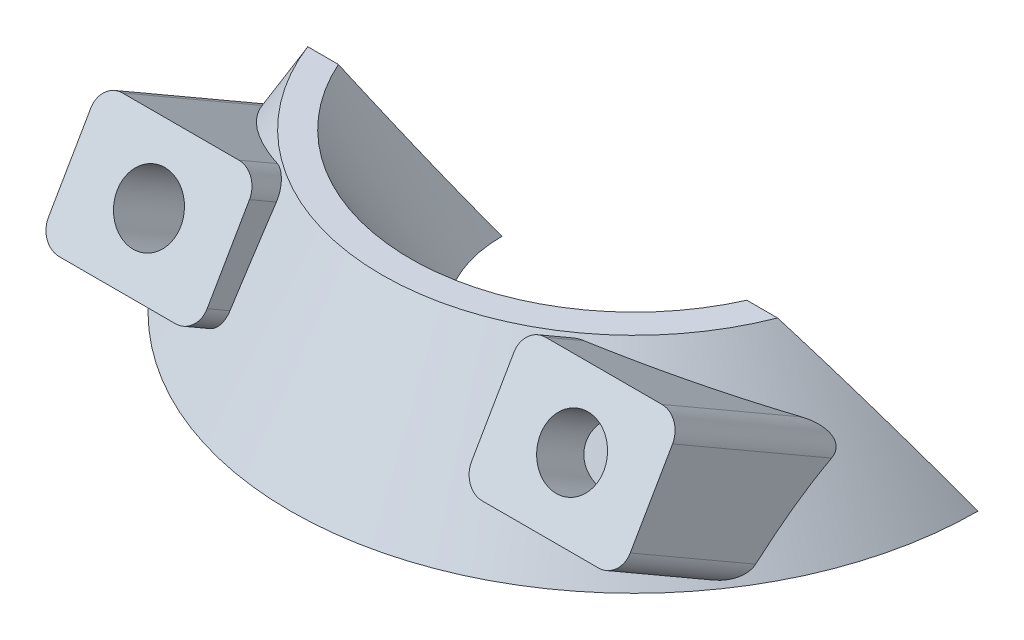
SolidWorks part; units mm, degrees
ref_plane "Front Plane" through (0, 0, 0) normal (0, 0, 1) x (1, 0, 0)
ref_plane "Top Plane" through (0, 0, 0) normal (0, 1, 0) x (1, 0, 0)
ref_plane "Right Plane" through (0, 0, 0) normal (1, 0, 0) x (0, 0, -1)
sketch "Sketch1" plane through (0, 0, 0) normal (0, 1, 0) x (1, 0, 0)
  line L0 (12.5, 0) -> (32.5, 0)
  line L1 (-12.5, 0) -> (-32.5, 0)
  arc A0 (20.5, 0) -> (-20.5, 0) centre (0, 0) cw construction
  arc A1 (12.5, 0) -> (-12.5, 0) centre (0, 0) cw
  arc A2 (32.5, 0) -> (-32.5, 0) centre (0, 0) cw
  dimension "D3" = 25
  dimension "D1" = 8
  dimension "D2" = 12
extrude "Extrude1" add sketch "Sketch1" along normal blind 15 draft 30
ref_plane "Plane1" through (0, 7.5, 28.1699) normal (0, 0.5, 0.866) x (1, 0, 0)
sketch "Sketch2" plane through (0, 7.5, 28.1699) normal (0, 0.5, 0.866) x (1, 0, 0)
  line L1 (14.5, -1.4103) -> (25.5, -1.4103)
  line L2 (12.5, 0.5897) -> (12.5, 8.5897)
  line L3 (14.5, 10.5897) -> (25.5, 10.5897)
  line L4 (27.5, 0.5897) -> (27.5, 8.5897)
  line L6 (14.5, 8.5897) -> (25.5, 0.5897) construction
  line L8 (0, -12.9904) -> (0, 27.3234) construction
  line L10 (-12.5, 0.5897) -> (-12.5, 8.5897)
  line L11 (-14.5, -1.4103) -> (-25.5, -1.4103)
  line L12 (-27.5, 0.5897) -> (-27.5, 8.5897)
  line L13 (-14.5, 10.5897) -> (-25.5, 10.5897)
  arc A0 (12.5, 8.5897) -> (14.5, 10.5897) centre (14.5, 8.5897) cw
  arc A1 (25.5, -1.4103) -> (27.5, 0.5897) centre (25.5, 0.5897) ccw
  arc A2 (14.5, -1.4103) -> (12.5, 0.5897) centre (14.5, 0.5897) cw
  arc A3 (25.5, 10.5897) -> (27.5, 8.5897) centre (25.5, 8.5897) cw
  circle A4 centre (20, 4.5897) radius 3
  circle A5 centre (-20, 4.5897) radius 3
  arc A6 (-12.5, 8.5897) -> (-14.5, 10.5897) centre (-14.5, 8.5897) ccw
  arc A7 (-14.5, -1.4103) -> (-12.5, 0.5897) centre (-14.5, 0.5897) ccw
  arc A8 (-25.5, -1.4103) -> (-27.5, 0.5897) centre (-25.5, 0.5897) cw
  arc A9 (-25.5, 10.5897) -> (-27.5, 8.5897) centre (-25.5, 8.5897) ccw
  point P12 (27.5, -1.4103)
  point P15 (12.5, -1.4103)
  point P18 (27.5, 10.5897)
  dimension "D2" = 15
  dimension "D3" = 12
  dimension "D4" = 2
  dimension "D5" = 6
  dimension "D1" = 3
  dimension "D6" = 20
extrude "Extrude2" add sketch "Sketch2" against normal up to surface (2.9382 mm away)
